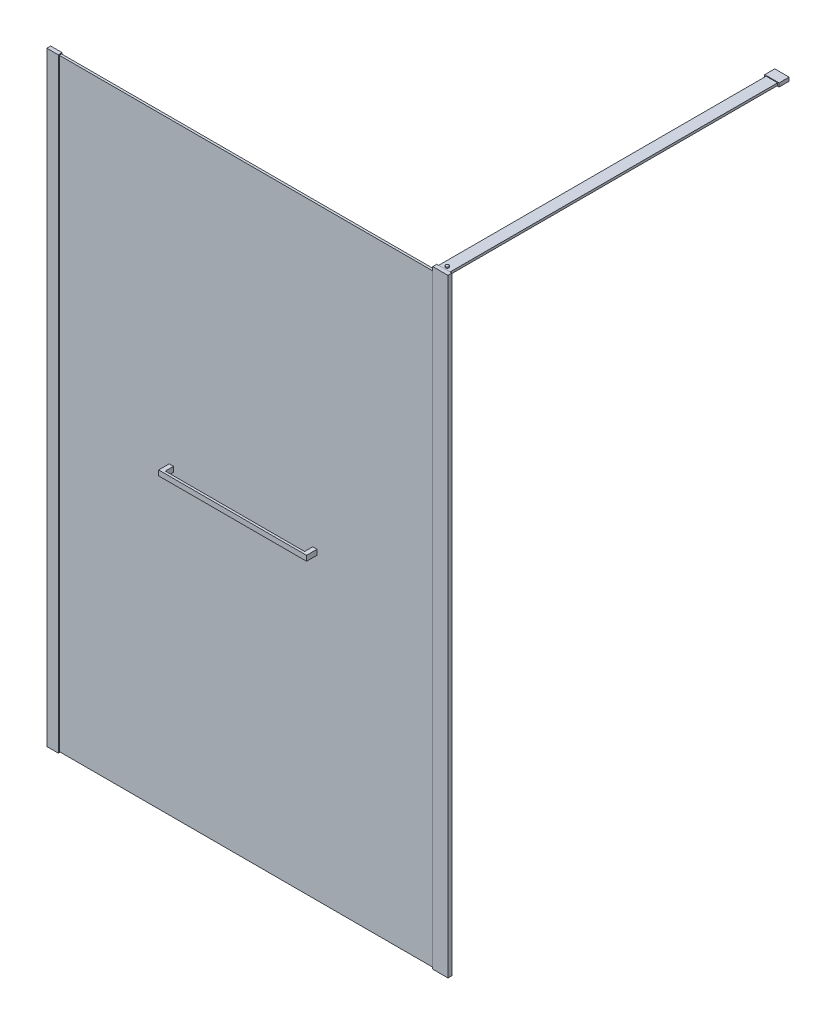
SolidWorks part; units mm, degrees
ref_plane "Płaszczyzna przednia" through (0, 0, 0) normal (0, 0, 1) x (1, 0, 0)
ref_plane "Płaszczyzna górna" through (0, 0, 0) normal (0, 1, 0) x (1, 0, 0)
ref_plane "Płaszczyzna prawa" through (0, 0, 0) normal (1, 0, 0) x (0, 0, -1)
sketch "Szkic1" plane through (0, 0, 0) normal (0, 1, 0) x (1, 0, 0)
  line L0 (0, 0) -> (0, 13.3)
  line L1 (0, 13.3) -> (40, 13.3)
  line L2 (40, 13.3) -> (40, 11.4)
  line L3 (40, 11.4) -> (6.5, 11.4)
  line L4 (6.5, 11.4) -> (6.5, 3.4)
  line L5 (6.5, 3.4) -> (40, 3.4)
  line L6 (40, 3.4) -> (40, 0)
  line L7 (40, 0) -> (0, 0)
  dimension "D1" = 40
  dimension "D2" = 13.3
  dimension "D3" = 33.5
  dimension "D4" = 1.9
  dimension "D5" = 8
extrude "Dodanie-wyciągnięcie1" add sketch "Szkic1" along normal blind 2100 from offset 3
sketch "Szkic2" plane through (0, 3, 0) normal (0, -1, 0) x (1, 0, 0)
  line L0 (6.5, -11.4) -> (40, -11.4) construction
  line L1 (6.5, -3.4) -> (1353.5, -3.4)
  line L2 (6.5, -3.4) -> (6.5, -11.4)
  line L3 (6.5, -11.4) -> (1353.5, -11.4)
  line L4 (1353.5, -3.4) -> (1353.5, -11.4)
  dimension "D1" = 1347
extrude "Dodanie-wyciągnięcie2" add sketch "Szkic2" against normal blind 2100 separate body
sketch "Szkic3" plane through (0, 3, 0) normal (0, -1, 0) x (1, 0, 0)
  line L0 (1343.4, -3.4) -> (1343.4, -0.4)
  line L1 (1353.5, -3.4) -> (6.5, -3.4) construction
  line L2 (1343.4, -0.4) -> (1396.4, -0.4)
  line L3 (1396.4, -0.4) -> (1396.4, -14.4)
  line L4 (1396.4, -14.4) -> (1343.4, -14.4)
  line L5 (1343.4, -14.4) -> (1343.4, -11.4)
  line L6 (1343.4, -11.4) -> (1353.5, -11.4)
  line L7 (1353.5, -11.4) -> (1353.5, -3.4)
  line L8 (1353.5, -3.4) -> (1343.4, -3.4)
  line L9 (6.5, -11.4) -> (1353.5, -11.4) construction
  line L10 (1353.5, -11.4) -> (1353.5, -3.4) construction
  dimension "D1" = 10.1
  dimension "D2" = 3
  dimension "D3" = 3
  dimension "D4" = 53
extrude "Dodanie-wyciągnięcie3" add sketch "Szkic3" against normal blind 2108 separate body
sketch "Szkic4" plane through (0, 2103, 0) normal (0, 1, 0) x (1, 0, 0)
  line L1 (0, 13.3) -> (40, 13.3)
  line L2 (0, 13.3) -> (0, 0)
  line L3 (0, 0) -> (40, 0)
  line L4 (40, 13.3) -> (40, 0)
extrude "Dodanie-wyciągnięcie4" add sketch "Szkic4" along normal blind 3
sketch "Szkic5" plane through (0, 2111, 0) normal (0, 1, 0) x (1, 0, 0)
  line L1 (1396.4, 14.4) -> (1343.4, 14.4)
  line L2 (1396.4, 14.4) -> (1396.4, 0.4)
  line L3 (1396.4, 0.4) -> (1343.4, 0.4)
  line L4 (1343.4, 14.4) -> (1343.4, 0.4)
extrude "Dodanie-wyciągnięcie5" add sketch "Szkic5" along normal blind 8
sketch "Szkic6" plane through (1343.4, 0, 0) normal (-1, 0, 0) x (0, 0, 1)
  line L0 (-11.4, 2111) -> (-3.4, 2111) construction
  line L1 (-3.35, 2111) -> (-11.45, 2111)
  line L2 (-3.35, 2111) -> (-3.35, 2103.2)
  line L3 (-3.35, 2103.2) -> (-11.45, 2103.2)
  line L4 (-11.45, 2111) -> (-11.45, 2103.2)
  point P6 (-7.4, 2111)
  dimension "D1" = 8.1
  dimension "D2" = 7.8
extrude "Dodanie-wyciągnięcie6" add sketch "Szkic6" against normal blind 15 from offset 1.3
sketch "Szkic7" plane through (0, 3, 0) normal (0, -1, 0) x (1, 0, 0)
  line L1 (1343.4, -0.4) -> (1396.4, -0.4)
  line L2 (1343.4, -0.4) -> (1343.4, -14.4)
  line L3 (1343.4, -14.4) -> (1396.4, -14.4)
  line L4 (1396.4, -0.4) -> (1396.4, -14.4)
extrude "Dodanie-wyciągnięcie7" add sketch "Szkic7" along normal blind 3
sketch "Szkic8" plane through (0, 3, 0) normal (0, -1, 0) x (1, 0, 0)
  line L1 (0, 0) -> (40, 0)
  line L2 (0, 0) -> (0, -13.3)
  line L3 (0, -13.3) -> (40, -13.3)
  line L4 (40, 0) -> (40, -13.3)
extrude "Dodanie-wyciągnięcie8" add sketch "Szkic8" along normal blind 3
sketch "Szkic9" plane through (0, 0, -14.4) normal (0, 0, -1) x (-1, 0, 0)
  line L0 (-1396.4, 2119) -> (-1343.4, 2119) construction
  line L1 (-1389.9, 2119) -> (-1349.9, 2119)
  line L2 (-1389.9, 2119) -> (-1389.9, 2111)
  line L3 (-1389.9, 2111) -> (-1349.9, 2111)
  line L4 (-1349.9, 2119) -> (-1349.9, 2111)
  line L5 (-1396.4, 2119) -> (-1396.4, 0) construction
  line L6 (-1343.4, 2119) -> (-1343.4, 0) construction
  dimension "D1" = 6.5
  dimension "D2" = 6.5
  dimension "D3" = 8
extrude "Dodanie-wyciągnięcie9" add sketch "Szkic9" along normal blind 1170 separate body
sketch "Szkic10" plane through (0, 0, -1184.4) normal (0, 0, -1) x (-1, 0, 0)
  line L0 (-1369.9, 2119) -> (-1369.9, 2115) construction
  line L1 (-1394.9, 2121.25) -> (-1344.9, 2121.25)
  line L2 (-1394.9, 2121.25) -> (-1394.9, 2108.75)
  line L3 (-1394.9, 2108.75) -> (-1344.9, 2108.75)
  line L4 (-1344.9, 2121.25) -> (-1344.9, 2108.75)
  line L5 (-1394.9, 2121.25) -> (-1344.9, 2108.75) construction
  line L6 (-1394.9, 2108.75) -> (-1344.9, 2121.25) construction
  line L7 (-1349.9, 2119) -> (-1389.9, 2119) construction
  line L8 (-1369.9, 2115) -> (-1389.9, 2115) construction
  line L9 (-1389.9, 2119) -> (-1389.9, 2111) construction
  point P0 (-1369.9, 2115)
  dimension "D1" = 12.5
  dimension "D2" = 50
extrude "Dodanie-wyciągnięcie10" add sketch "Szkic10" along normal blind 35 from offset 29.4
ref_plane "Płaszczyzna1" through (1369.9, 0, 0) normal (1, 0, 0) x (0, 0, -1)
sketch "Szkic11" plane through (1369.9, 0, 0) normal (1, 0, 0) x (0, 0, -1)
  line L0 (24.4, 2119) -> (24.4, 2127.4416) construction
  line L1 (24.4, 2119) -> (34.6926, 2119) construction
  line L2 (30.3, 2119) -> (30.05, 2122.8)
  line L3 (24.4, 2124.7) -> (30.2413, 2124.7) construction
  line L4 (24.4, 2124.7) -> (24.4, 2124.2)
  line L5 (1155, 2119) -> (14.4, 2119) construction
  line L6 (14.4, 2119) -> (14.4, 2111) construction
  line L7 (29.7989, 2119) -> (30.3, 2119)
  line L9 (29.5663, 2122.5357) -> (29.7989, 2119)
  arc A0 (24.4, 2124.7) -> (30.05, 2122.8) centre (24.4, 2115.3493) cw
  arc A1 (29.5663, 2122.5357) -> (24.4, 2124.2) centre (24.4, 2115.3493) ccw
  dimension "D1" = 0.5
  dimension "D2" = 11.3
  dimension "D3" = 5.7
  dimension "D4" = 3.8
  dimension "D5" = 11.8
  dimension "D6" = 0.5
  dimension "D7" = 10
revolve "Obrót1" add sketch "Szkic11" angle 360 about L0
sketch "Szkic12" plane through (0, 0, -3.4) normal (0, 0, 1) x (1, 0, 0)
  line L0 (680, 1409.7928) -> (680, 762.3594) construction
  line L1 (430, 1053) -> (930, 1053) construction
  line L2 (6.5, 2103) -> (6.5, 3) construction
  line L3 (1353.5, 2103) -> (1353.5, 3) construction
  line L5 (422.5, 1062) -> (437.5, 1062)
  line L6 (422.5, 1062) -> (422.5, 1044)
  line L7 (422.5, 1044) -> (437.5, 1044)
  line L8 (437.5, 1062) -> (437.5, 1044)
  line L9 (422.5, 1062) -> (437.5, 1044) construction
  line L10 (422.5, 1044) -> (437.5, 1062) construction
  line L11 (922.5, 1062) -> (937.5, 1062)
  line L12 (922.5, 1062) -> (922.5, 1044)
  line L13 (922.5, 1044) -> (937.5, 1044)
  line L14 (937.5, 1062) -> (937.5, 1044)
  line L15 (922.5, 1062) -> (937.5, 1044) construction
  line L16 (922.5, 1044) -> (937.5, 1062) construction
  dimension "D1" = 1053
  dimension "D2" = 500
  dimension "D3" = 15
  dimension "D4" = 18
extrude "Dodanie-wyciągnięcie11" add sketch "Szkic12" along normal blind 36.5 and the other way blind 18 separate body
sketch "Szkic13" plane through (437.5, 0, 0) normal (1, 0, 0) x (0, 0, -1)
  line L0 (21.4, 1044) -> (-33.1, 1044) construction
  line L1 (-33.1, 1062) -> (-25.1, 1062)
  line L2 (-33.1, 1062) -> (-33.1, 1044)
  line L3 (-33.1, 1044) -> (-25.1, 1044)
  line L4 (-25.1, 1062) -> (-25.1, 1044)
  dimension "D1" = 8
extrude "Dodanie-wyciągnięcie12" add sketch "Szkic13" along normal up to surface (485 mm away)
